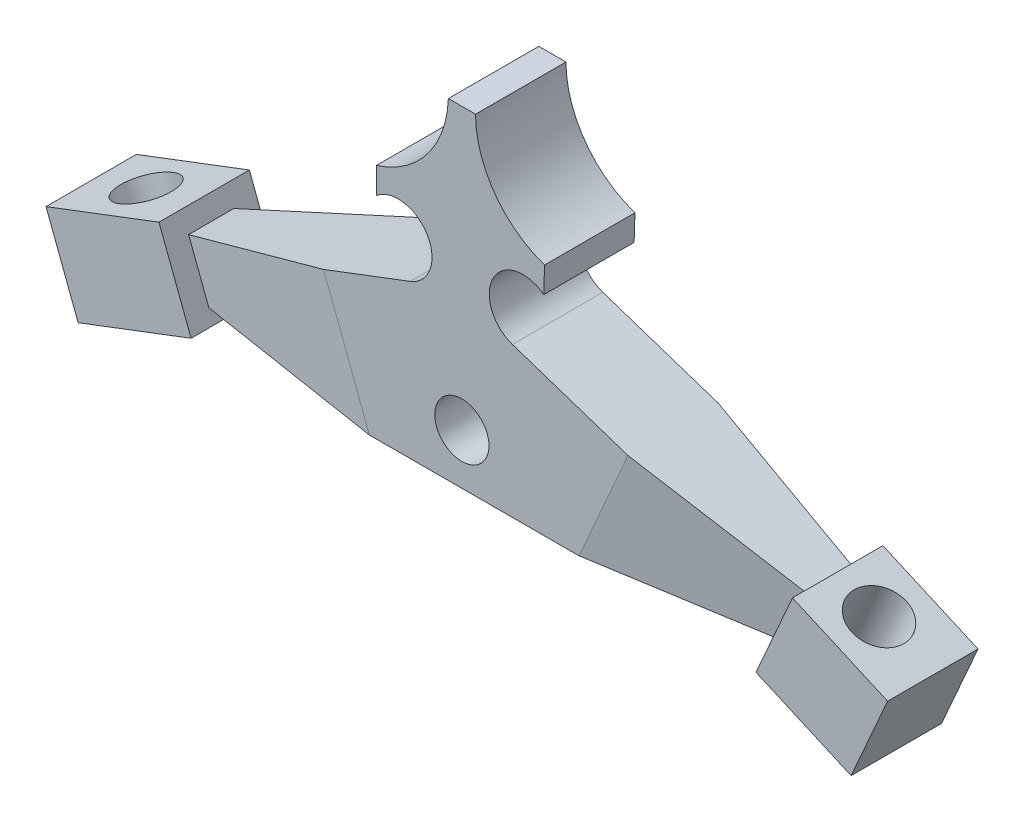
SolidWorks part; units mm, degrees
ref_plane "Front Plane" through (0, 0, 0) normal (0, 0, 1) x (1, 0, 0)
ref_plane "Top Plane" through (0, 0, 0) normal (0, 1, 0) x (1, 0, 0)
ref_plane "Right Plane" through (0, 0, 0) normal (1, 0, 0) x (0, 0, -1)
sketch "Sketch1" plane through (0, 0, 0) normal (0, 0, 1) x (1, 0, 0)
  line L3 (-42.4468, -10.9324) -> (-29.9507, -6.1781)
  line L4 (32.5386, -6.9301) -> (43.0606, -11.5709)
  line L5 (-46.0028, -1.586) -> (-33.5067, 3.1683)
  line L6 (-46.0028, -1.586) -> (-42.4468, -10.9324)
  line L7 (-33.5067, 3.1683) -> (-29.9507, -6.1781)
  line L8 (36.574, 2.2195) -> (47.0961, -2.4213)
  line L9 (36.574, 2.2195) -> (32.5386, -6.9301)
  line L10 (47.0961, -2.4213) -> (43.0606, -11.5709)
  dimension "D8" = 13.37
  dimension "D11" = 11.5
  dimension "D12" = 10
  dimension "D13" = 10
extrude "Boss-Extrude1" add sketch "Sketch1" along normal blind 10
ref_plane "Plane1" through (0, 0, 5) normal (0, 0, 1) x (1, 0, 0)
sketch "Sketch2" plane through (0, 0, 5) normal (0, 0, 1) x (1, 0, 0)
  line L0 (1.5099, 31.0196) -> (-1.4901, 31.0196)
  line L1 (-29.9507, -6.1781) -> (-33.5067, 3.1683) construction
  line L2 (11.2217, -9.478) -> (-8.7542, -9.478)
  line L3 (-8.7542, -9.478) -> (-15.3066, 7.7442)
  line L4 (-15.3066, 7.7442) -> (-5.7101, 11.3953)
  line L5 (-9.4505, 20.6349) -> (-9.4505, 17.7497)
  line L6 (11.2217, -9.478) -> (18.3801, 6.7522)
  line L7 (18.3801, 6.7522) -> (5.5919, 11.0028)
  line L8 (9.1467, 20.3947) -> (9.0578, 17.5109)
  line L9 (36.574, 2.2195) -> (32.5386, -6.9301) construction
  circle A0 centre (0, 0) radius 3
  arc A1 (-1.4901, 31.0196) -> (-9.4505, 20.6349) centre (-12.7569, 31.4127) cw
  arc A2 (-5.7101, 11.3953) -> (-9.4505, 17.7497) centre (-7.0399, 14.8906) ccw
  arc A3 (5.5919, 11.0028) -> (9.0578, 17.5109) centre (6.7714, 14.5516) cw
  arc A4 (1.5099, 31.0196) -> (9.1467, 20.3947) centre (12.7834, 31.0656) ccw
  point P3 (0, -3)
  point P29 (33.5985, -4.5271)
  dimension "D1" = 6
extrude "Boss-Extrude7" add sketch "Sketch2" along normal mid plane 10 separate body
sketch "Sketch7" plane through (0, 0, 5) normal (0, 0, 1) x (1, 0, 0)
  line L0 (-15.3066, 7.7442) -> (-32.7261, 1.1167)
  line L1 (-29.9507, -6.1781) -> (-33.5067, 3.1683) construction
  line L2 (-5.7101, 11.3953) -> (-15.3066, 7.7442) construction
  line L3 (18.3801, 6.7522) -> (35.9915, 0.8986)
  line L4 (36.574, 2.2195) -> (32.5386, -6.9301) construction
  line L5 (18.3801, 6.7522) -> (5.5919, 11.0028) construction
  line L6 (-32.7261, 1.1167) -> (-30.4858, -4.7715)
  line L7 (-30.4858, -4.7715) -> (-10.2343, -5.5876)
  line L8 (12.9494, -5.5609) -> (33.4491, -4.8656)
  line L9 (33.4491, -4.8656) -> (35.9915, 0.8986)
  line L10 (-15.3066, 7.7442) -> (-10.2343, -5.5876)
  line L11 (-15.3066, 7.7442) -> (-8.7542, -9.478) construction
  line L12 (18.3801, 6.7522) -> (12.9494, -5.5609)
  line L13 (11.2217, -9.478) -> (18.3801, 6.7522) construction
  dimension "D1" = 6.3
  dimension "D2" = 6.3
extrude "Boss-Extrude8" add sketch "Sketch7" along normal mid plane 10
sketch "Sketch8" plane through (-4.5093, 11.8522, 0) normal (-0.3556, 0.9346, 0) x (0.9346, 0.3556, 0)
  line L0 (-11.5523, -10) -> (-30.19, -7.5)
  line L1 (-30.19, -10) -> (-30.19, 0) construction
  line L2 (-30.19, -7.5) -> (-30.19, -10)
  line L3 (-30.19, -10) -> (-11.5523, -10)
  line L4 (-23.4248, -5) -> (23.4248, -5) construction
  line L5 (-3.8672, -5) -> (-35.2447, -5)
  line L6 (-30.19, -2.5) -> (-30.19, 0)
  line L7 (-30.19, 0) -> (-11.5523, 0)
  line L8 (-11.5523, 0) -> (-30.19, -2.5)
  dimension "D1" = 2.5
extrude "Cut-Extrude5" cut sketch "Sketch8" against normal blind 15 contours L8 M5 M6 | L0 M7 M6
sketch "Sketch11" plane through (6.7755, 15.3622, 0) normal (0.4035, 0.915, 0) x (0.915, -0.4035, 0)
  line L0 (14.0922, -10) -> (32.5681, -7.5)
  line L1 (32.5681, -10) -> (32.5681, 0) construction
  line L2 (32.5681, -7.5) -> (32.5681, -10)
  line L3 (32.5681, -10) -> (14.0922, -10)
  line L4 (38.8659, -5) -> (11.2335, -5)
  line L5 (-23.4248, -5) -> (23.4248, -5) construction
  line L6 (32.5681, 0) -> (14.0922, 0)
  line L7 (14.0922, 0) -> (32.5681, -2.5)
  line L8 (32.5681, -2.5) -> (32.5681, 0)
  dimension "D1" = 2.5
extrude "Cut-Extrude6" cut sketch "Sketch11" against normal blind 21 contours L3 L0 M6 | L6 L7 L8
sketch "Sketch12" plane through (-5.2899, 13.9038, 0) normal (-0.3556, 0.9346, 0) x (0.9346, 0.3556, 0)
  line L0 (-43.56, -10) -> (-43.56, 0) construction
  line L2 (-43.56, -10) -> (-43.56, 0)
  circle A0 centre (-37.06, -5) radius 3
  dimension "D2" = 6
extrude "Cut-Extrude7" cut sketch "Sketch12" against normal blind 21 contours A0
sketch "Sketch13" plane through (6.7755, 15.3622, 0) normal (0.4035, 0.915, 0) x (0.915, -0.4035, 0)
  line L0 (44.0681, -10) -> (44.0681, 0) construction
  line L1 (44.0681, -10) -> (44.0681, 0)
  circle A0 centre (37.5681, -5) radius 3
  dimension "D2" = 6
extrude "Cut-Extrude8" cut sketch "Sketch13" against normal blind 21 contours A0
sketch "Sketch14" plane through (0, 0, 10) normal (0, 0, 1) x (1, 0, 0)
  line L0 (-10.2343, -5.5876) -> (12.9494, -5.5609)
  line L1 (-10.2343, -5.5876) -> (-8.7542, -9.478) construction
  line L2 (-10.2343, -5.5876) -> (-8.7542, -9.478)
  line L3 (-8.7542, -9.478) -> (11.2217, -9.478) construction
  line L4 (-8.7542, -9.478) -> (11.2217, -9.478)
  line L5 (11.2217, -9.478) -> (12.9494, -5.5609) construction
  line L6 (11.2217, -9.478) -> (12.9494, -5.5609)
extrude "Cut-Extrude10" cut sketch "Sketch14" against normal blind 10
